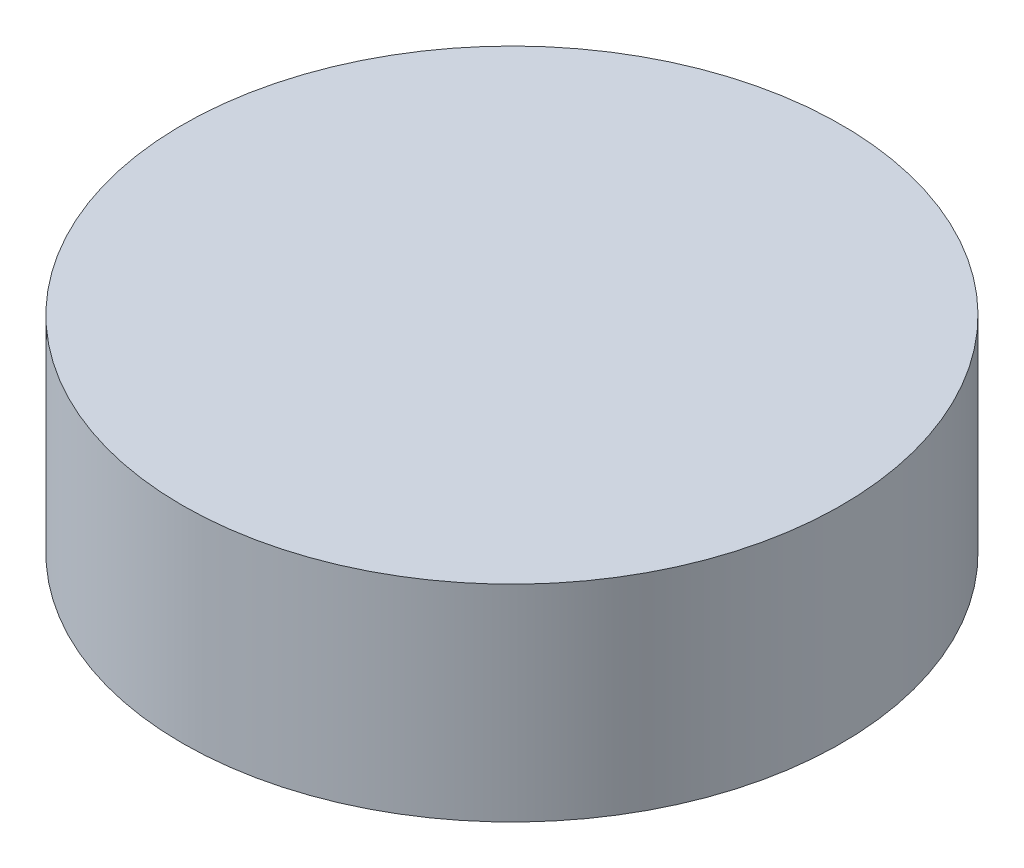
SolidWorks part; units mm, degrees
ref_plane "Alzado" through (0, 0, 0) normal (0, 0, 1) x (1, 0, 0)
ref_plane "Planta" through (0, 0, 0) normal (0, 1, 0) x (1, 0, 0)
ref_plane "Vista lateral" through (0, 0, 0) normal (1, 0, 0) x (0, 0, -1)
sketch "Croquis1" plane through (0, 0, 0) normal (0, 1, 0) x (1, 0, 0)
  circle A0 centre (0, 0) radius 40
  dimension "D1" = 80
extrude "Saliente-Extruir1" add sketch "Croquis1" along normal blind 25
